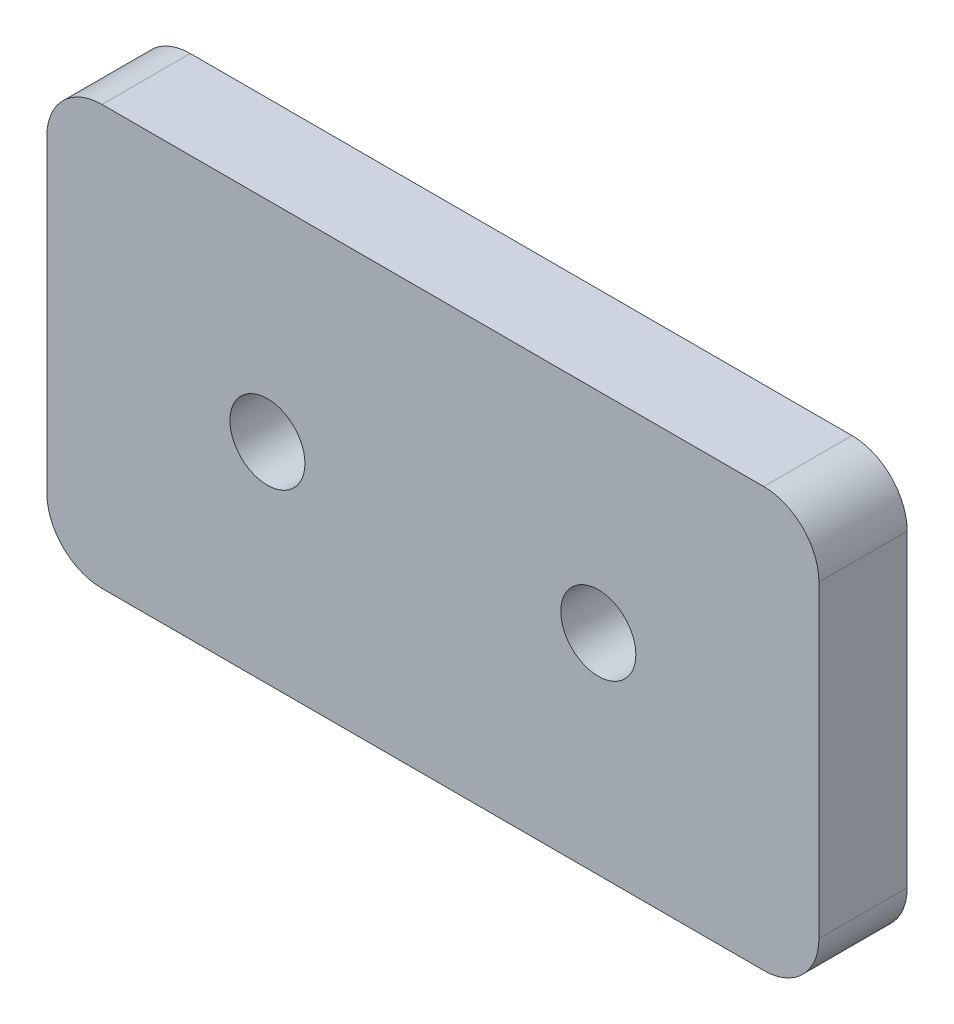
SolidWorks part; units mm, degrees
ref_plane "Plan de face" through (0, 0, 0) normal (0, 0, 1) x (1, 0, 0)
ref_plane "Plan de dessus" through (0, 0, 0) normal (0, 1, 0) x (1, 0, 0)
ref_plane "Plan de droite" through (0, 0, 0) normal (1, 0, 0) x (0, 0, -1)
sketch "Esquisse1" plane through (0, 0, 0) normal (0, 0, 1) x (1, 0, 0)
  line L0 (0, 19) -> (70, 19) construction
  line L1 (0, 0) -> (70, 0)
  line L2 (0, 0) -> (0, 38)
  line L3 (0, 38) -> (70, 38)
  line L4 (70, 0) -> (70, 38)
  circle A0 centre (20, 19) radius 3.4
  circle A1 centre (50, 19) radius 3.4
  dimension "D3" = 6.8
  dimension "D1" = 38
  dimension "D2" = 70
  dimension "D4" = 30
  dimension "D5" = 20
extrude "Extrusion1" add sketch "Esquisse1" along normal blind 8
fillet "Congé1" radius 5 4 edges at (70, 38, 4) (70, 0, 4) (0, 0, 4) (0, 38, 4)
